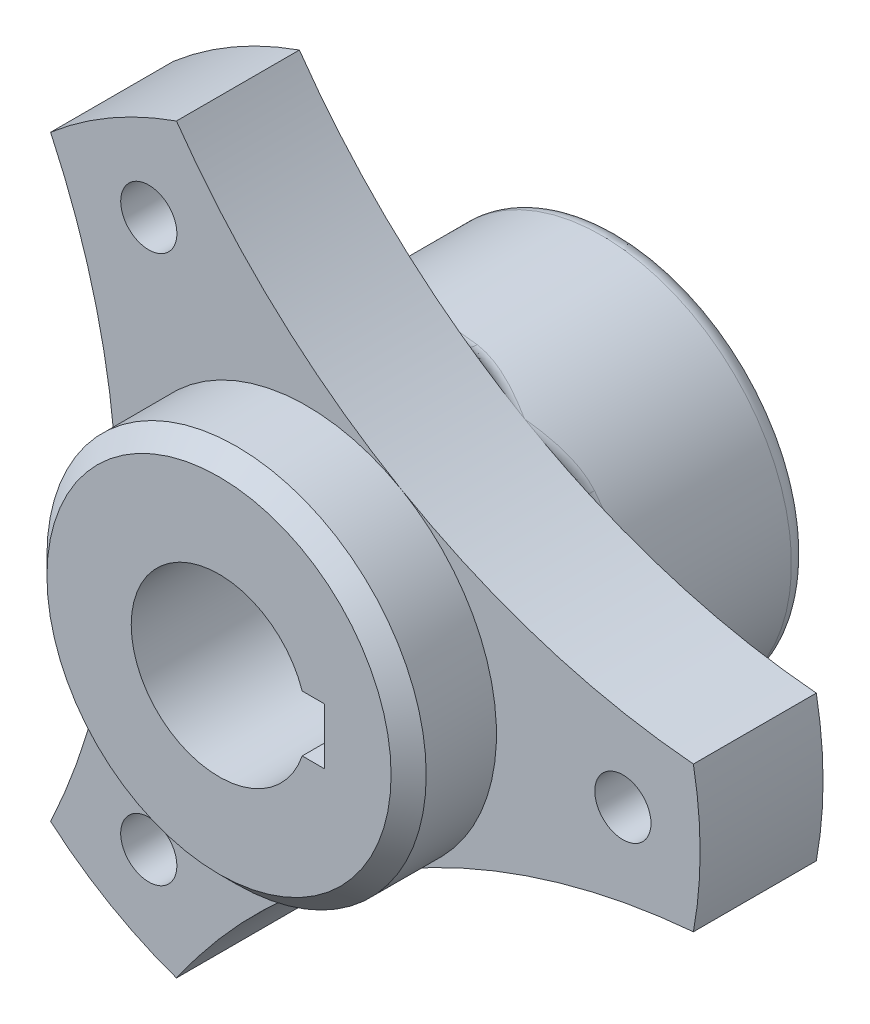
SolidWorks part; units mm, degrees
ref_plane "Plan1" through (0, 0, 0) normal (0, 0, 1) x (1, 0, 0)
ref_plane "Plan2" through (0, 0, 0) normal (0, 1, 0) x (1, 0, 0)
ref_plane "Plan3" through (0, 0, 0) normal (1, 0, 0) x (0, 0, -1)
sketch "Esquisse1" plane through (0, 0, 0) normal (0, 0, 1) x (1, 0, 0)
  arc A0 (-36.4764, -42.4909) -> (-18.56, -52.8349) centre (0, 0) ccw
  arc A1 (-36.4764, -42.4909) -> (-36.4764, 42.4909) centre (-127, 0) ccw
  arc A2 (-18.56, 52.8349) -> (55.0364, 10.344) centre (63.5, 109.9852) ccw
  arc A3 (55.0364, -10.344) -> (-18.56, -52.8349) centre (63.5, -109.9852) ccw
  arc A4 (-18.56, 52.8349) -> (-36.4764, 42.4909) centre (0, 0) ccw
  arc A5 (55.0364, -10.344) -> (55.0364, 10.344) centre (0, 0) ccw
  dimension "D1" = 112
  dimension "D2" = 200
  dimension "D4" = 200
  dimension "D7" = 200
  dimension "D3" = 127
  dimension "D6" = 127
  dimension "D8" = 127
extrude "Base-Extrusion" add sketch "Esquisse1" along normal blind 17.5
sketch "Esquisse2" plane through (0, 0, 17.5) normal (0, 0, 1) x (1, 0, 0)
  circle A0 centre (0, 0) radius 27
  arc A1 (-36.4764, -42.4909) -> (-36.4764, 42.4909) centre (-127, 0) ccw construction
  arc A2 (-18.56, 52.8349) -> (-36.4764, 42.4909) centre (0, 0) ccw construction
extrude "Boss.-Extru.1" add sketch "Esquisse2" along normal blind 12.5
chamfer "Chanfrein1" distance 2.5 angle 45
sketch "Esquisse3" plane through (0, 0, 0) normal (0, 0, -1) x (-1, 0, 0)
  circle A0 centre (0, 0) radius 27
  arc A1 (36.4764, 42.4909) -> (18.56, 52.8349) centre (0, 0) ccw construction
  arc A2 (-55.0364, 10.344) -> (18.56, 52.8349) centre (-63.5, 109.9852) ccw construction
extrude "Boss.-Extru.2" add sketch "Esquisse3" along normal blind 27
fillet "Congé1" radius 2.5
fillet "Congé2" radius 2.5
sketch "Esquisse4" plane through (0, 0, -27) normal (0, 0, -1) x (-1, 0, 0)
  circle A0 centre (0, 0) radius 12.5
  circle A3 centre (0, 0) radius 27 construction
  dimension "D1" = 25
extrude "Enlèv. mat.-Extru.1" cut sketch "Esquisse4" against normal through all
sketch "Esquisse5" plane through (0, 0, -27) normal (0, 0, -1) x (-1, 0, 0)
  line L0 (-10, 4) -> (-15, 4)
  line L1 (-10, 4) -> (-10, -4)
  line L2 (-15, -4) -> (-10, -4)
  line L3 (-15, -4) -> (-15, 4)
  dimension "D4" = 15
  dimension "D1" = 5
  dimension "D2" = 8
  dimension "D3" = 4
extrude "Enlèv. mat.-Extru.3" cut sketch "Esquisse5" against normal through all
sketch "Esquisse7" plane through (0, 0, 0) normal (0, 0, -1) x (-1, 0, 0)
  circle A0 centre (22.5, 38.9711) radius 4
  dimension "D1" = 8
  dimension "D2" = 45
extrude "Enlèv. mat.-Extru.5" cut sketch "Esquisse7" against normal through all
sketch "Esquisse9" plane through (0, 0, 17.5) normal (0, 0, 1) x (1, 0, 0)
  line L0 (0, 0) -> (70, 0) construction
  line L1 (0, 0) -> (-30.5112, 52.847) construction
  circle A0 centre (-22.5, 38.9711) radius 4
  circle A1 centre (45, 0) radius 4
  circle A2 centre (-22.5, -38.9711) radius 4
  dimension "D3" = 8
  dimension "D1" = 120
  dimension "D2" = 45
extrude "Enlèv. mat.-Extru.6" cut sketch "Esquisse9" against normal through all
